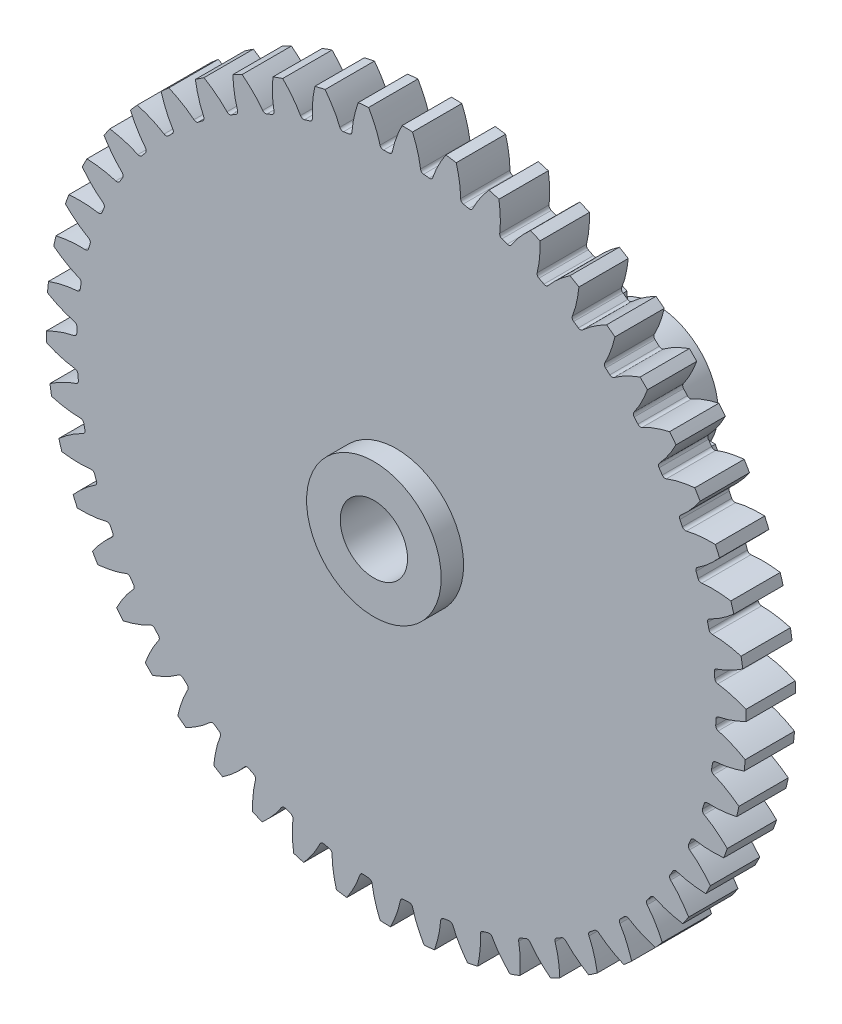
SolidWorks part; units mm, degrees
ref_plane "Face" through (0, 0, 0) normal (0, 0, 1) x (1, 0, 0)
ref_plane "Dessus" through (0, 0, 0) normal (0, 1, 0) x (1, 0, 0)
ref_plane "Droite" through (0, 0, 0) normal (1, 0, 0) x (0, 0, -1)
other "Joindre1"
other "Roue Z5 m=0,45 Z=18<1>@Z4-Z5"
other "Roue Z4 m=0,3 Z=50<1>@Z4-Z5"
sketch "Dp" plane through (0, 0, 0) normal (0, 0, -1) x (-1, 0, 0)
  circle A0 centre (0, 0) radius 4.05 construction
  circle A1 centre (0, 0) radius 7.5 construction
  dimension "D1" = 8.1
  dimension "D2" = 15
